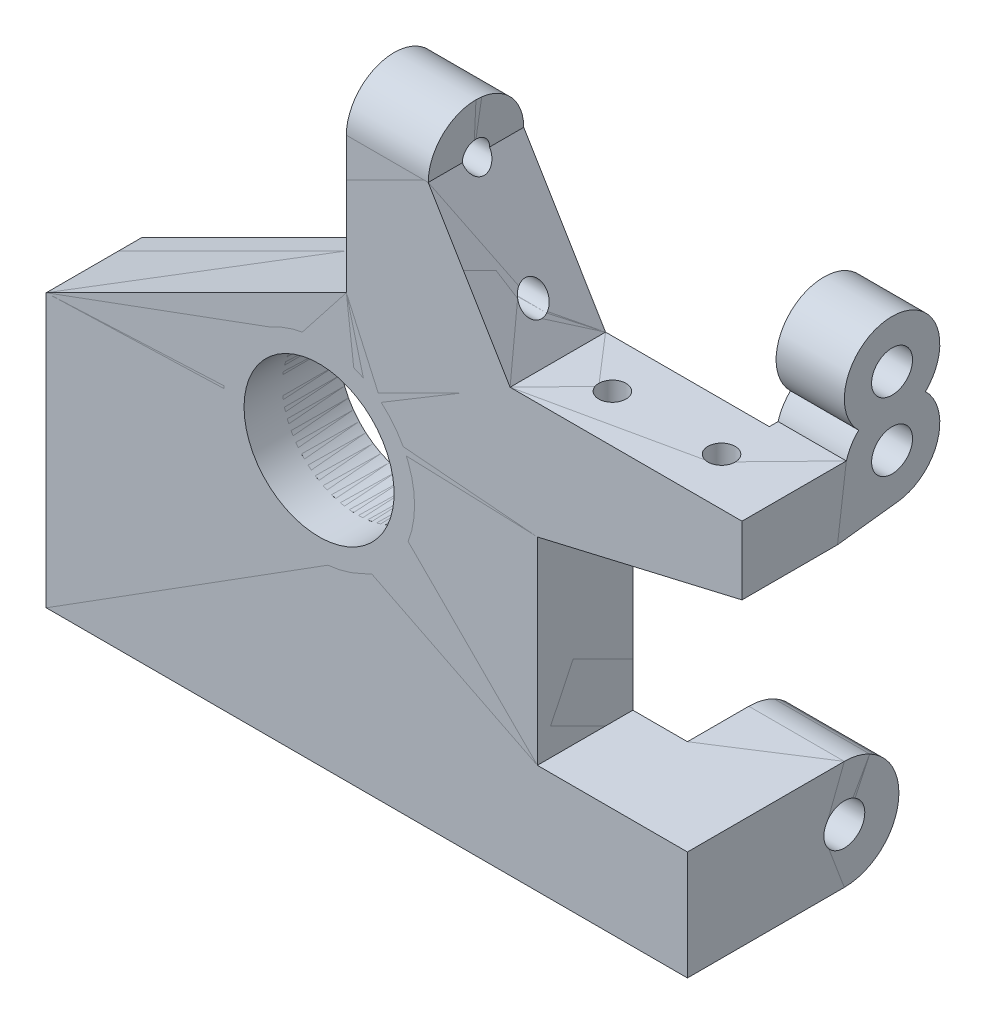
SolidWorks part; units mm, degrees
ref_plane "Plan1" through (0, 0, 0) normal (0, 0, 1) x (1, 0, 0)
ref_plane "Plan2" through (0, 0, 0) normal (0, 1, 0) x (1, 0, 0)
ref_plane "Plan3" through (0, 0, 0) normal (1, 0, 0) x (0, 0, -1)
imported_body "Importée1"
sketch "Esquisse2" plane through (0, 0, 0) normal (0, 0, 1) x (1, 0, 0)
  circle A0 centre (-20, -10) radius 7
  circle A1 centre (-20, -10) radius 5.5 construction
  dimension "D1" = 14
extrude "Enlèv. mat.-Extru.1" cut sketch "Esquisse2" against normal blind 2.8
